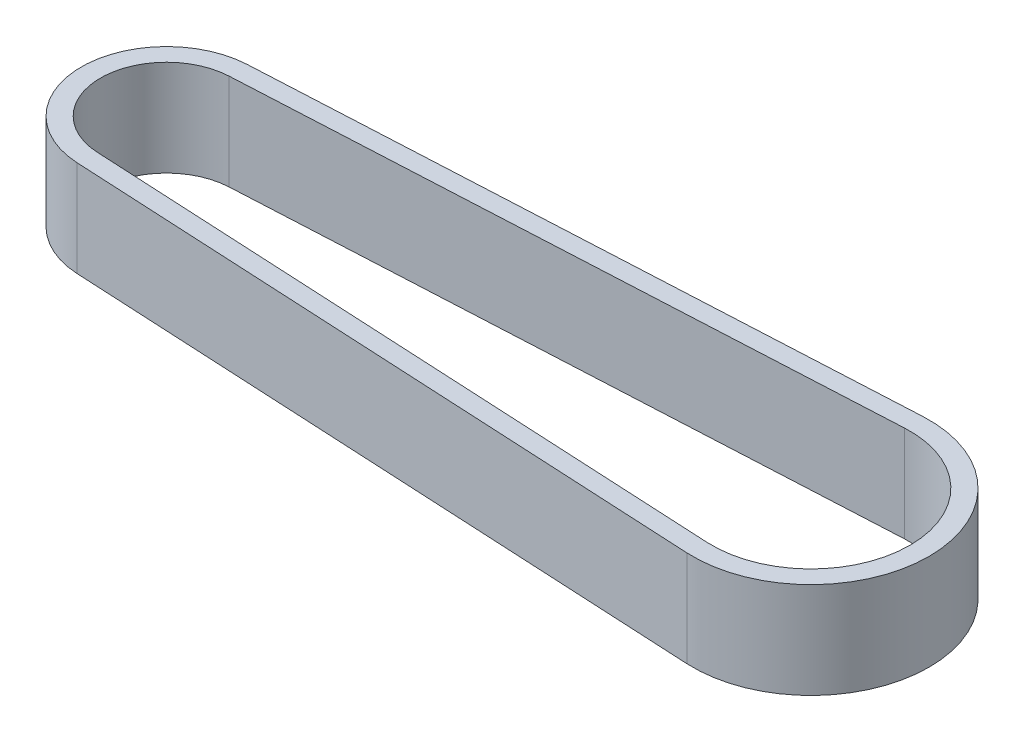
SolidWorks part; units mm, degrees
ref_plane "Front Plane" through (0, 0, 0) normal (0, 0, 1) x (1, 0, 0)
ref_plane "Top Plane" through (0, 0, 0) normal (0, 1, 0) x (1, 0, 0)
ref_plane "Right Plane" through (0, 0, 0) normal (1, 0, 0) x (0, 0, -1)
sketch "Croquis1" plane through (0, 0, 0) normal (0, 1, 0) x (1, 0, 0)
  line L0 (-67.12, 0) -> (67.12, 0) construction
  line L1 (-67.8242, 13.732) -> (66.0637, 20.5979)
  line L2 (66.0637, -20.5979) -> (-67.8242, -13.732)
  line L3 (-68.0291, 17.7267) -> (65.8588, 24.5927)
  line L4 (65.8588, -24.5927) -> (-68.0291, -17.7267)
  arc A0 (66.0637, -20.5979) -> (66.0637, 20.5979) centre (67.12, 0) ccw
  arc A1 (-67.8242, 13.732) -> (-67.8242, -13.732) centre (-67.12, 0) ccw
  arc A2 (-53.37, 0) -> (-67.8242, 13.732) centre (-67.12, 0) ccw construction
  arc A3 (-67.8242, -13.732) -> (-53.37, 0) centre (-67.12, 0) ccw construction
  arc A4 (46.495, 0) -> (66.0637, -20.5979) centre (67.12, 0) ccw construction
  arc A5 (66.0637, 20.5979) -> (46.495, 0) centre (67.12, 0) ccw construction
  arc A6 (65.8588, -24.5927) -> (65.8588, 24.5927) centre (67.12, 0) ccw
  arc A7 (-68.0291, 17.7267) -> (-68.0291, -17.7267) centre (-67.12, 0) ccw
  point P4 (0, 0)
  dimension "D1" = 27.5
  dimension "D2" = 41.25
  dimension "D4" = 4
  dimension "D3" = 134.24
extrude "Saliente-Extruir1" add sketch "Croquis1" along normal mid plane 20
